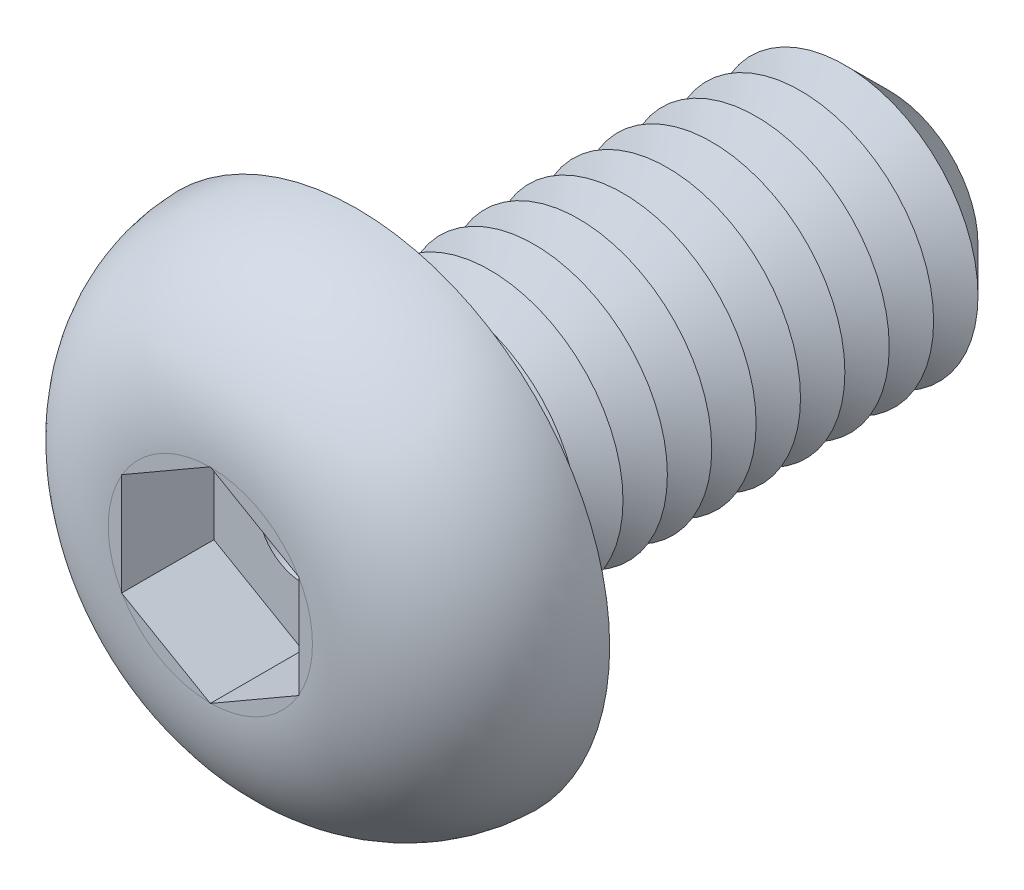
SolidWorks part; units mm, degrees
ref_plane "Front Plane" through (0, 0, 0) normal (0, 0, 1) x (1, 0, 0)
ref_plane "Top Plane" through (0, 0, 0) normal (0, 1, 0) x (1, 0, 0)
ref_plane "Right Plane" through (0, 0, 0) normal (1, 0, 0) x (0, 0, -1)
sketch "Sketch1" plane through (0, 0, 0) normal (1, 0, 0) x (0, 0, -1)
  line L0 (-47.9342, 0) -> (60.3146, 0) construction
sketch "Sketch2" plane through (0, 0, 0) normal (1, 0, 0) x (0, 0, -1)
  line L0 (0, 0) -> (-1.65, 0)
  line L1 (-47.9342, 0) -> (60.3146, 0) construction
  line L2 (-1.65, 0) -> (-1.65, 1.1507)
  line L3 (0, 2.85) -> (0, 0)
  arc A0 (-1.65, 1.1507) -> (0, 2.85) centre (0.05, 1.1507) cw
  dimension "D1" = 1.7
  dimension "D2" = 1.65
  dimension "D3" = 2.85
revolve "Revolve1" add sketch "Sketch2" angle 360 about L0
sketch "Sketch3" plane through (0, 0, 1.65) normal (0, 0, 1) x (1, 0, 0)
  line L1 (0, 1.1547) -> (-1, 0.5774)
  line L2 (-1, 0.5774) -> (-1, -0.5774)
  line L3 (-1, -0.5774) -> (0, -1.1547)
  line L4 (0, -1.1547) -> (1, -0.5774)
  line L5 (1, -0.5774) -> (1, 0.5774)
  line L6 (1, 0.5774) -> (0, 1.1547)
  circle A0 centre (0, 0) radius 1 construction
  dimension "D1" = 2
extrude "Cut-Extrude1" cut sketch "Sketch3" against normal blind 1.04
sketch "Sketch4" plane through (0, 0, 0) normal (0, 0, -1) x (-1, 0, 0)
  circle A0 centre (0, 0) radius 1.5
  dimension "D1" = 3
extrude "Boss-Extrude1" add sketch "Sketch4" along normal blind 6
chamfer "Chamfer1" distance 0.5 angle 45 1 edges at (-1.5, 0, -6)
sketch "Sketch5" plane through (0, 0, 0) normal (1, 0, 0) x (0, 0, -1)
  line L0 (0.5, 1.5) -> (1, 1.5)
  line L1 (5.5, 1.5) -> (0, 1.5) construction
  line L2 (1, 1.5) -> (0.75, 1.067)
  line L3 (0.75, 1.067) -> (0.5, 1.5)
  line L4 (0, -2.85) -> (0, 2.85) construction
  line L5 (5.5, 1.5) -> (0, 1.5) construction
  dimension "D1" = 0.5
  dimension "D2" = 0.5
revolve "Cut-Revolve1" cut sketch "Sketch5" angle 360 about L0
pattern_linear "LPattern1" count 10 spacing 0.5 along (0, 0, -1) of "Cut-Revolve1"
fillet "Fillet2" radius 0.25 1 edges at (1.5, 0, 0)
sketch "Sketch6" plane through (0, 0, 0.61) normal (0, 0, 1) x (1, 0, 0)
  circle A0 centre (0, 0) radius 0.5
  dimension "D1" = 1
extrude "Cut-Extrude2" cut sketch "Sketch6" against normal up to surface (6.61 mm away)
